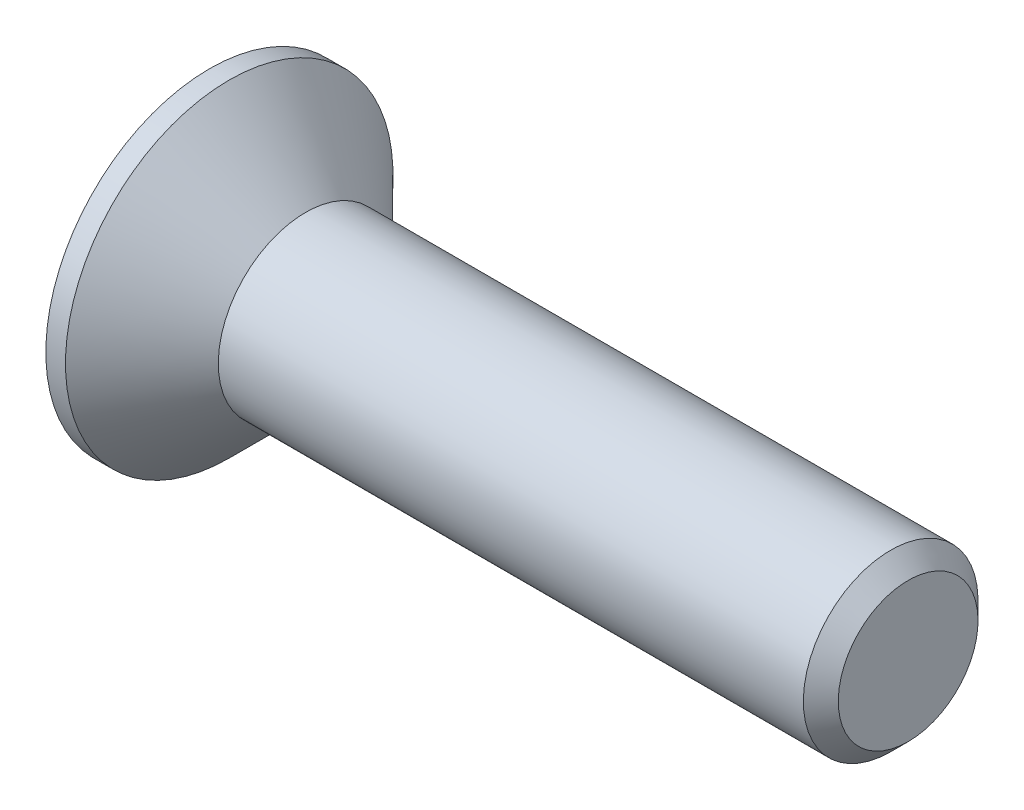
SolidWorks part; units mm, degrees
ref_plane "Front Plane" through (0, 0, 0) normal (0, 0, 1) x (1, 0, 0)
ref_plane "Top Plane" through (0, 0, 0) normal (0, 1, 0) x (1, 0, 0)
ref_plane "Right Plane" through (0, 0, 0) normal (1, 0, 0) x (0, 0, -1)
sketch "Sketch1" plane through (0, 0, 0) normal (0, 0, 1) x (1, 0, 0)
  line L1 (-2.2, 3.75) -> (-2.2, 0)
  line L2 (-2.2, 0) -> (13.8, 0)
  line L3 (13.8, 0) -> (13.8, 2)
  line L4 (13.8, 2) -> (0, 2)
  line L5 (-2.2, 3.75) -> (-1.75, 3.75)
  line L6 (-1.75, 3.75) -> (0, 2)
  dimension "D1" = 2
  dimension "D2" = 45
  dimension "D3" = 2.2
  dimension "D4" = 16
  dimension "D5" = 3.75
revolve "Revolve1" add sketch "Sketch1" angle 360 about L2
chamfer "Chamfer1" distance 0.4 angle 45 1 edges at (13.8, -2, 0)
sketch "Sketch2" plane through (-2.2, 0, 0) normal (-1, 0, 0) x (0, 0, 1)
  line L0 (-0.55, 2.2) -> (0.55, 2.2)
  line L1 (0.55, 2.2) -> (0.55, 0.55)
  line L2 (0.55, 0.55) -> (2.2, 0.55)
  line L3 (2.2, 0.55) -> (2.2, -0.55)
  line L4 (2.2, -0.55) -> (0.55, -0.55)
  line L5 (0.55, -0.55) -> (0.55, -2.2)
  line L6 (0.55, -2.2) -> (-0.55, -2.2)
  line L7 (-0.55, -2.2) -> (-0.55, -0.55)
  line L8 (-0.55, -0.55) -> (-2.2, -0.55)
  line L9 (-2.2, -0.55) -> (-2.2, 0.55)
  line L10 (-2.2, 0.55) -> (-0.55, 0.55)
  line L11 (-0.55, 0.55) -> (-0.55, 2.2)
  point P2 (0, 2.2)
  point P14 (0, -2.2)
  point P15 (2.2, 0)
  point P16 (-2.2, 0)
  dimension "D1" = 4.4
  dimension "D2" = 1.1
extrude "Cut-Extrude1" cut sketch "Sketch2" against normal blind 1.9
